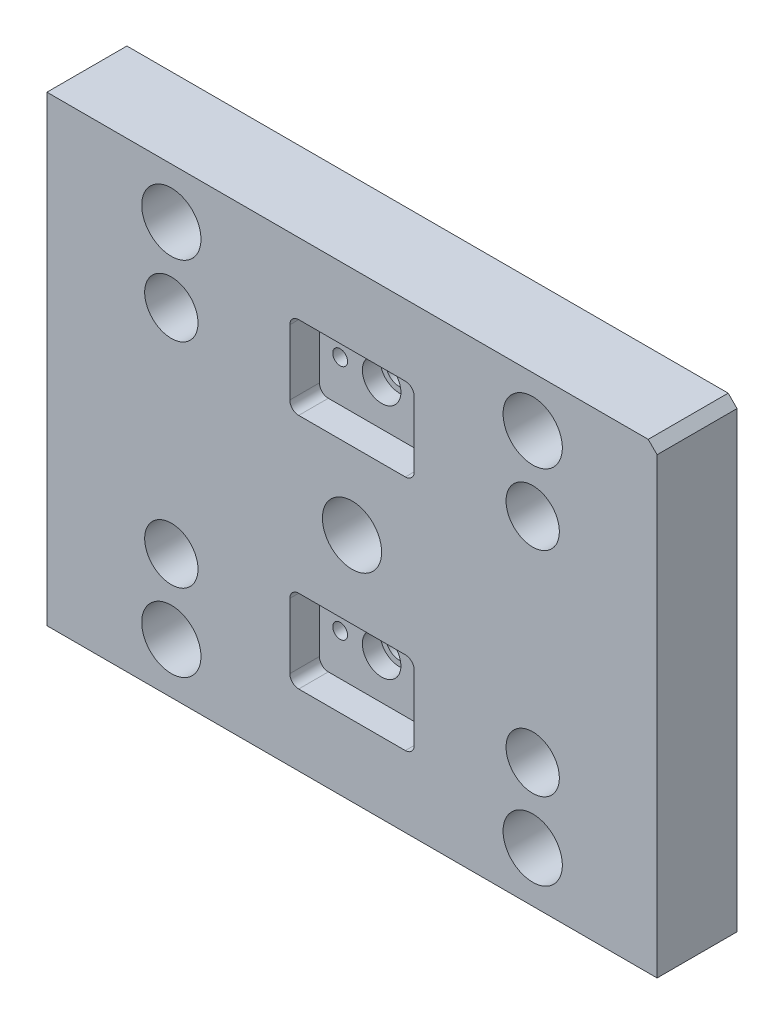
SolidWorks part; units mm, degrees
ref_plane "Plan de face" through (0, 0, 0) normal (0, 0, 1) x (1, 0, 0)
ref_plane "Plan de dessus" through (0, 0, 0) normal (0, 1, 0) x (1, 0, 0)
ref_plane "Plan de droite" through (0, 0, 0) normal (1, 0, 0) x (0, 0, -1)
sketch "Esquisse1" plane through (0, 0, 0) normal (0, 0, 1) x (1, 0, 0)
  line L1 (-103, 78) -> (103, 78)
  line L2 (-103, 78) -> (-103, -78)
  line L3 (-103, -78) -> (103, -78)
  line L4 (103, 78) -> (103, -78)
  point P4 (0, 78)
  point P7 (-103, 0)
  dimension "D1" = 206
  dimension "D2" = 156
extrude "Extrusion1" add sketch "Esquisse1" along normal blind 27
sketch "Esquisse3" plane through (0, 0, 27) normal (0, 0, 1) x (1, 0, 0)
  circle A0 centre (-61, 61) radius 10
  circle A1 centre (-61, 36) radius 5.25
  dimension "D1" = 61
  dimension "D2" = 61
  dimension "D3" = 20
  dimension "D4" = 61
  dimension "D5" = 36
  dimension "D6" = 10.5
extrude "Enlèv. mat.-Extru.1" cut sketch "Esquisse3" against normal through all
sketch "Esquisse13" plane through (0, 0, 27) normal (0, 0, 1) x (1, 0, 0)
  circle A0 centre (-61, 36) radius 9
  dimension "D1" = 18
extrude "Enlèv. mat.-Extru.9" cut sketch "Esquisse13" against normal blind 13
mirror "Symétrie1" about plane through (0, 0, 0) normal (1, 0, 0) of "Enlèv. mat.-Extru.9", "Enlèv. mat.-Extru.1"
mirror "Symétrie2" about plane through (0, 0, 0) normal (0, 1, 0) of "Symétrie1", "Enlèv. mat.-Extru.1", "Enlèv. mat.-Extru.9"
sketch "Esquisse5" plane through (0, 0, 27) normal (0, 0, 1) x (1, 0, 0)
  line L0 (-17.5, 0) -> (-17.5, -24)
  line L1 (17.5, 0) -> (17.5, -24)
  arc A0 (17.5, 0) -> (-17.5, 0) centre (0, 0) ccw
  arc A1 (-17.5, -24) -> (17.5, -24) centre (0, -24) ccw
  dimension "D1" = 17.5
  dimension "D3" = 24
extrude "Passage attelage" [suppressed] cut sketch "Esquisse5" against normal blind 21
sketch "Esquisse8" [suppressed] plane through (0, 0, 6) normal (0, 0, 1) x (1, 0, 0)
  circle A0 centre (0, 0) radius 8
  dimension "D1" = 16
extrude "Enlèv. mat.-Extru.5" [suppressed] cut sketch "Esquisse8" against normal through all
sketch "Esquisse10" plane through (0, 0, 27) normal (0, 0, 1) x (1, 0, 0)
  line L0 (-21, -40) -> (21, -40) construction
  line L1 (-21, -26) -> (21, -26)
  line L2 (-21, -26) -> (-21, -54)
  line L3 (-21, -54) -> (21, -54)
  line L4 (21, -26) -> (21, -54)
  line L5 (0, -26) -> (0, -54) construction
  dimension "D1" = 28
  dimension "D2" = 40
  dimension "D3" = 42
extrude "Enlèv. mat.-Extru.6" cut sketch "Esquisse10" against normal blind 10
fillet "Congé1" radius 3 4 edges at (-21, -54, 22) (21, -54, 22) (21, -26, 22) (-21, -26, 22)
sketch "Esquisse17" plane through (0, 0, 27) normal (0, 0, 1) x (1, 0, 0)
  circle A0 centre (0, 0) radius 10
  dimension "D1" = 20
extrude "Enlèv. mat.-Extru.12" cut sketch "Esquisse17" against normal through all
chamfer "Chanfrein_D" distance 3 angle 45 1 edges at (103, 78, 13.5)
mirror "Symétrie3" about plane through (0, 0, 0) normal (0, 1, 0) of "Enlèv. mat.-Extru.6", "Congé1"
sketch "Esquisse18" plane through (0, 0, 0) normal (0, 0, -1) x (-1, 0, 0)
  line L0 (0, 0) -> (0, -87.6031) construction
  circle A0 centre (0, -40) radius 4.6
  circle A1 centre (0, 40) radius 4.6
  dimension "D2" = 9.2
  dimension "D3" = 40
  dimension "D4" = 40
extrude "Enlèv. mat.-Extru.13" cut sketch "Esquisse18" against normal through all
sketch "Esquisse19" plane through (0, 0, 17) normal (0, 0, 1) x (1, 0, 0)
  circle A0 centre (0, 40) radius 6.5
  circle A1 centre (0, -40) radius 6.5
  dimension "D1" = 13
extrude "Enlèv. mat.-Extru.14" cut sketch "Esquisse19" against normal blind 6
hole_wizard "Trou taraudé M61" positions "Esquisse22" profile "Esquisse21" tap size "M6" standard "ISO"
sketch "Esquisse22" plane through (0, 0, 17) normal (0, 0, 1) x (1, 0, 0)
  line L0 (-6.5, 40) -> (6.5, 40) construction
  line L2 (0, 40) -> (0, 54) construction
  line L3 (-18, 54) -> (18, 54) construction
  circle A0 centre (0, 40) radius 6.5 construction
  point P0 (14, 40)
  point P1 (-14, 40)
  dimension "D1" = 14
  dimension "D2" = 14
sketch "Esquisse21" plane through (14, 40, 17) normal (1, 0, 0) x (0, -1, 0)
  line L0 (0, 0) -> (0, 18.5022)
  line L1 (0, 18.5022) -> (2.5, 17)
  line L2 (2.5, 17) -> (2.5, 0)
  line L5 (2.5, 0) -> (0, 0)
  line L10 (0, 18.5022) -> (-2.5, 17) construction
  line L11 (0, -6.35) -> (0, 107.95) construction
  dimension "Diamètre du trou pour taraudage" = 5
  dimension "Profondeur du trou pour taraudage" = 17
  dimension "Angle de pointe" = 118
mirror "Symétrie4" about plane through (0, 0, 0) normal (0, 1, 0) of "Trou taraudé M61"
